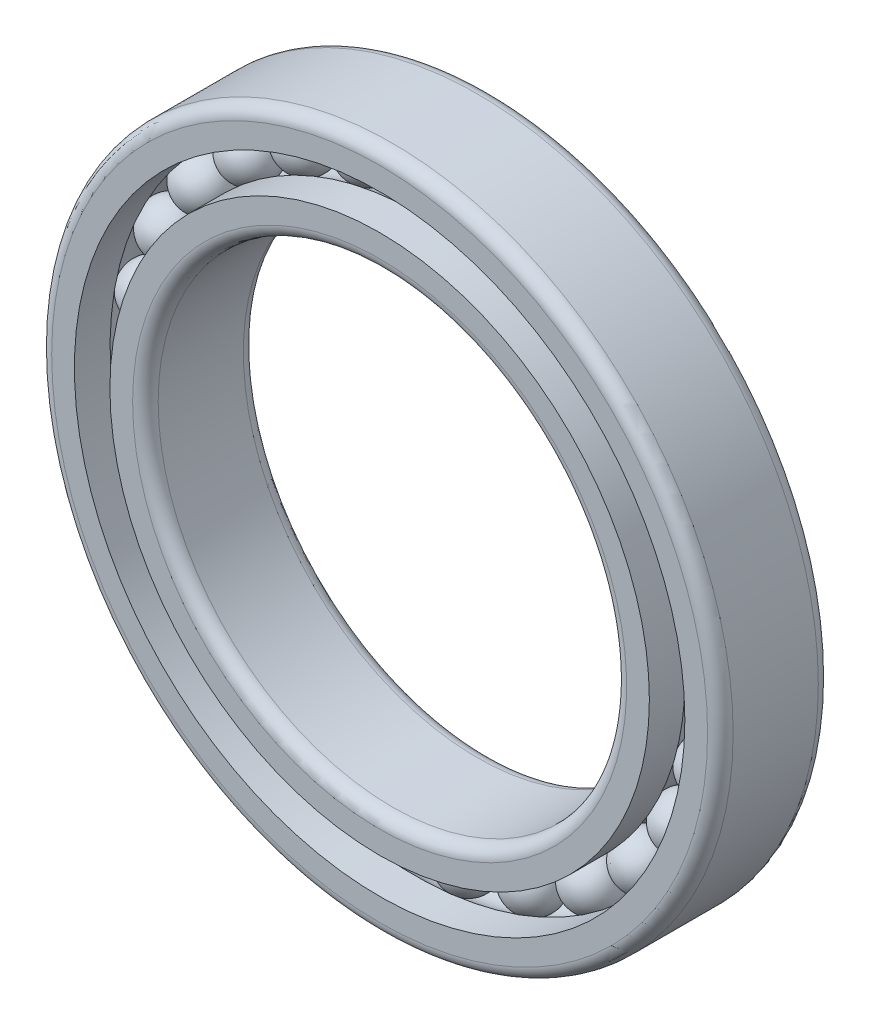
SolidWorks part; units mm, degrees
ref_plane "Front Plane" through (0, 0, 0) normal (0, 0, 1) x (1, 0, 0)
ref_plane "Top Plane" through (0, 0, 0) normal (0, 1, 0) x (1, 0, 0)
ref_plane "Right Plane" through (0, 0, 0) normal (1, 0, 0) x (0, 0, -1)
sketch "BaseSke" plane through (0, 0, 0) normal (1, 0, 0) x (0, 0, -1)
  line L0 (-47.2296, 0) -> (24.6132, 0) construction
  line L1 (-47.2296, 33.75) -> (24.6132, 33.75) construction
  line L2 (0, 129.5214) -> (0, -86.3012) construction
  line L3 (0, 36.875) -> (0, 30.625)
  line L4 (-6.5, 40) -> (6.5, 40) construction
  line L5 (-6.5, 27.5) -> (6.5, 27.5) construction
  arc A0 (0, 36.875) -> (0, 30.625) centre (0, 33.75) ccw
  dimension "Ball_diameter" = 6.25
  dimension "D1" = 33.75
  dimension "Bearing_Thickness" = 13
  dimension "Bearing_Outside_Diameter" = 80
  dimension "Bearing_Inside_Diameter" = 55
revolve "Ball" add sketch "BaseSke" angle 360 about L3
sketch "OuterRaceSke" plane through (0, 0, 0) normal (1, 0, 0) x (0, 0, -1)
  line L0 (0, 0) -> (0, 87.5396) construction
  line L1 (-6.5, 40) -> (6.5, 40)
  line L2 (-6.5, 40) -> (-6.5, 35.8333)
  line L3 (-6.5, 35.8333) -> (-2.3158, 35.8333)
  line L4 (6.5, 40) -> (6.5, 35.8333)
  line L5 (-50.3916, 0) -> (55.2197, 0) construction
  line L6 (-47.2296, 33.75) -> (24.6132, 33.75) construction
  line L7 (2.3158, 35.8333) -> (6.5, 35.8333)
  arc A0 (2.3158, 35.8333) -> (-2.3158, 35.8333) centre (0, 33.75) ccw
  dimension "D4" = 6.23
  dimension "D2" = 71.6667
revolve "OuterRace" add sketch "OuterRaceSke" angle 360 about L5
sketch "InnerRaceSke" plane through (0, 0, 0) normal (1, 0, 0) x (0, 0, -1)
  line L0 (-70.8626, 0) -> (113.5527, 0) construction
  line L1 (0, 58.441) -> (0, -70.8113) construction
  line L2 (-6.5, 27.5) -> (6.5, 27.5)
  line L3 (-6.5, 27.5) -> (-6.5, 31.6667)
  line L4 (-6.5, 31.6667) -> (-2.3158, 31.6667)
  line L5 (6.5, 27.5) -> (6.5, 31.6667)
  line L6 (0, 129.5214) -> (0, -86.3012) construction
  line L7 (2.3158, 31.6667) -> (6.5, 31.6667)
  arc A0 (-2.3158, 31.6667) -> (2.3158, 31.6667) centre (0, 33.75) ccw
  arc A1 (0, 36.875) -> (0, 30.625) centre (0, 33.75) ccw construction
  dimension "D2" = 6.23
  dimension "D1" = 63.3333
revolve "InnerRace" add sketch "InnerRaceSke" angle 360 about L0
fillet "Fillet1" radius 1.5 4 edges at (27.5, 0, -6.5) (27.5, 0, 6.5) (40, 0, -6.5) (40, 0, 6.5)
sketch "ShieldedSke" plane through (0, 0, 0) normal (1, 0, 0) x (0, 0, -1)
  line L1 (-5.75, 35.8333) -> (-4.3333, 35.8333)
  line L2 (-6.5, 35.0833) -> (-6.5, 32.4167)
  line L3 (-5.75, 31.6667) -> (-4.3333, 31.6667)
  line L4 (-4.3333, 35.8333) -> (-4.3333, 31.6667)
  arc A0 (-5.75, 35.8333) -> (-6.5, 35.0833) centre (-5.75, 35.0833) ccw
  arc A1 (-6.5, 32.4167) -> (-5.75, 31.6667) centre (-5.75, 32.4167) ccw
  point P12 (-6.5, 35.8333)
  point P13 (-6.5, 31.6667)
  dimension "D1" = 0.75
  dimension "D2" = 4.3333
revolve "Shielded" [suppressed] add sketch "ShieldedSke" angle 360 about L0
mirror "DoubleShielded" [suppressed] about plane through (0, 0, 0) normal (0, 0, 1)
sketch "SealedSke" plane through (0, 0, 0) normal (1, 0, 0) x (0, 0, -1)
  line L0 (-34.5153, 0) -> (39.09, 0) construction
  line L1 (-25.2, 31.6667) -> (-5.2, 31.6667)
  line L2 (-25.2, 31.6667) -> (-25.2, 35.8333)
  line L3 (-25.2, 35.8333) -> (-5.2, 35.8333)
  line L4 (-5.2, 31.6667) -> (-5.2, 35.8333)
  dimension "D1" = 20
  dimension "D2" = 5.2
revolve "Sealed" [suppressed] cut sketch "SealedSke" angle 360 about L0
mirror "DoubleSealed" [suppressed] about plane through (0, 0, 0) normal (0, 0, 1)
pattern_circular "CirPatternBall" count 27 over 360 about axis through (0, 0, 0) along (0, 0, 1) of "Ball"
sketch "CutGrooveSke" plane through (0, 0, 0) normal (1, 0, 0) x (0, 0, -1)
  line L0 (-51.8407, 0) -> (83.8302, 0) construction
  line L1 (3.9, -59.2) -> (3.25, -59.2)
  line L2 (3.9, -59.2) -> (3.9, -39.2)
  line L3 (3.9, -39.2) -> (3.25, -39.2)
  line L4 (3.25, -59.2) -> (3.25, -39.2)
  dimension "D1" = 39.2
  dimension "D2" = 3.25
  dimension "D3" = 0.65
  dimension "D4" = 20
revolve "CutGroove" [suppressed] cut sketch "CutGrooveSke" angle 360 about L0
sketch "TaperSke" plane through (0, 0, 0) normal (1, 0, 0) x (0, 0, -1)
  line L0 (-6.5, 27.5) -> (6.5, 27.5)
  line L1 (6.5, 27.5) -> (6.5, 28.5833)
  line L2 (6.5, 28.5833) -> (-6.5, 27.5)
  line L7 (-41.2502, 0) -> (40.8606, 0) construction
  dimension "Taper" = 1.0833
revolve "Taper" [suppressed] cut sketch "TaperSke" angle 360 about L7
fillet "Fillet2" [suppressed] radius 1.5
sketch "SimplifiedSke" plane through (0, 0, 0) normal (1, 0, 0) x (0, 0, -1)
  line L0 (37.5911, 0) -> (-37.5911, 0) construction
  circle A0 centre (0, 33.75) radius 3.125
  arc A1 (0, 36.875) -> (0, 30.625) centre (0, 33.75) ccw construction
revolve "Simplified" [suppressed] add sketch "SimplifiedSke" angle 360 about L0
equation "\"D1@BaseSke\" =  (\"Bearing_Outside_Diameter@BaseSke\"  +  \"Bearing_Inside_Diameter@BaseSke\"  )  / 4"
equation "\"Ball_diameter@BaseSke\" =  ( \"Bearing_Outside_Diameter@BaseSke\" - \"Bearing_Inside_Diameter@BaseSke\" ) / 4 "
equation "\"D2@OuterRaceSke\" = \"Bearing_Outside_Diameter@BaseSke\" -  ( \"Bearing_Outside_Diameter@BaseSke\" - \"Bearing_Inside_Diameter@BaseSke\" )  / 3"
equation "\"D4@OuterRaceSke\" = (  \"Bearing_Outside_Diameter@BaseSke\" - \"Bearing_Inside_Diameter@BaseSke\" ) / 4 -0.02"
equation "\"D1@InnerRaceSke\" = \"Bearing_Inside_Diameter@BaseSke\" +  ( \"Bearing_Outside_Diameter@BaseSke\" - \"Bearing_Inside_Diameter@BaseSke\" )  / 3"
equation "\"D2@InnerRaceSke\" = \"D4@OuterRaceSke\""
equation "\"D1@ShieldedSke\" = \"Fillet_radius@Fillet1\"/2"
equation "\"D2@ShieldedSke\" = \"Bearing_Thickness@BaseSke\"/3"
equation "\"D2@SealedSke\" = \"Bearing_Thickness@BaseSke\"/2.5"
equation "\"D1@CirPatternBall\" = int( \"D1@BaseSke\"* pi  * 2 / \"Ball_diameter@BaseSke\"/1.2 ) -1"
equation "\"D1@CutGrooveSke\" = \"Bearing_Outside_Diameter@BaseSke\" * 0.49"
equation "\"D2@CutGrooveSke\" = \"Bearing_Thickness@BaseSke\" *0.25"
equation "\"D3@CutGrooveSke\" = \"Bearing_Thickness@BaseSke\"/20"
equation "\"Taper@TaperSke\" = \"Bearing_Thickness@BaseSke\"/12"
equation "\"D1@Fillet2\" = \"Fillet_radius@Fillet1\""
